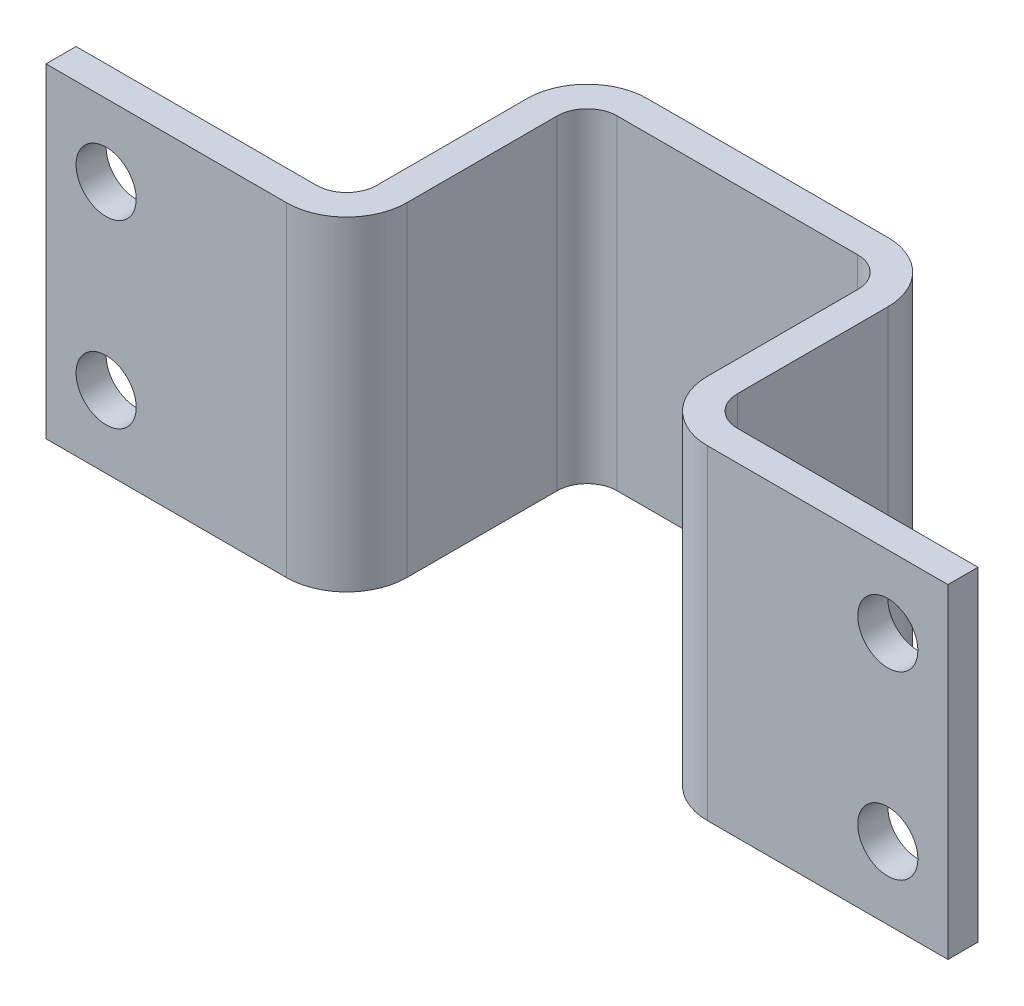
SolidWorks part; units mm, degrees
ref_plane "Front Plane" through (0, 0, 0) normal (0, 0, 1) x (1, 0, 0)
ref_plane "Top Plane" through (0, 0, 0) normal (0, 1, 0) x (1, 0, 0)
ref_plane "Right Plane" through (0, 0, 0) normal (1, 0, 0) x (0, 0, -1)
sketch "Sketch1" plane through (0, 0, 0) normal (0, 1, 0) x (1, 0, 0)
  line L0 (-75, 0) -> (-30, 0)
  line L1 (-30, 0) -> (-30, 40)
  line L2 (-30, 40) -> (30, 40)
  line L3 (30, 40) -> (30, 0)
  line L4 (30, 0) -> (75, 0)
  line L5 (0, 0) -> (0, 40) construction
  dimension "D1" = 45
  dimension "D2" = 150
  dimension "D3" = 60
  dimension "D4" = 40
extrude "Extrude-Thin1" add sketch "Sketch1" along normal blind 54 thin
sketch "Sketch2" plane through (0, 0, 5) normal (0, 0, 1) x (1, 0, 0)
  line L0 (75, 54) -> (75, 0) construction
  line L1 (65, 42) -> (65, 12) construction
  line L2 (-75, 27) -> (75, 27) construction
  line L3 (-75, 54) -> (-75, 0) construction
  line L4 (35, 54) -> (75, 54) construction
  line L5 (0, 0) -> (0, 55.1791) construction
  circle A0 centre (65, 42) radius 5
  circle A1 centre (65, 12) radius 5
  circle A2 centre (-65, 12) radius 5
  circle A3 centre (-65, 42) radius 5
  dimension "D1" = 10
  dimension "D2" = 10
  dimension "D3" = 12
extrude "Cut-Extrude1" cut sketch "Sketch2" against normal up to next
